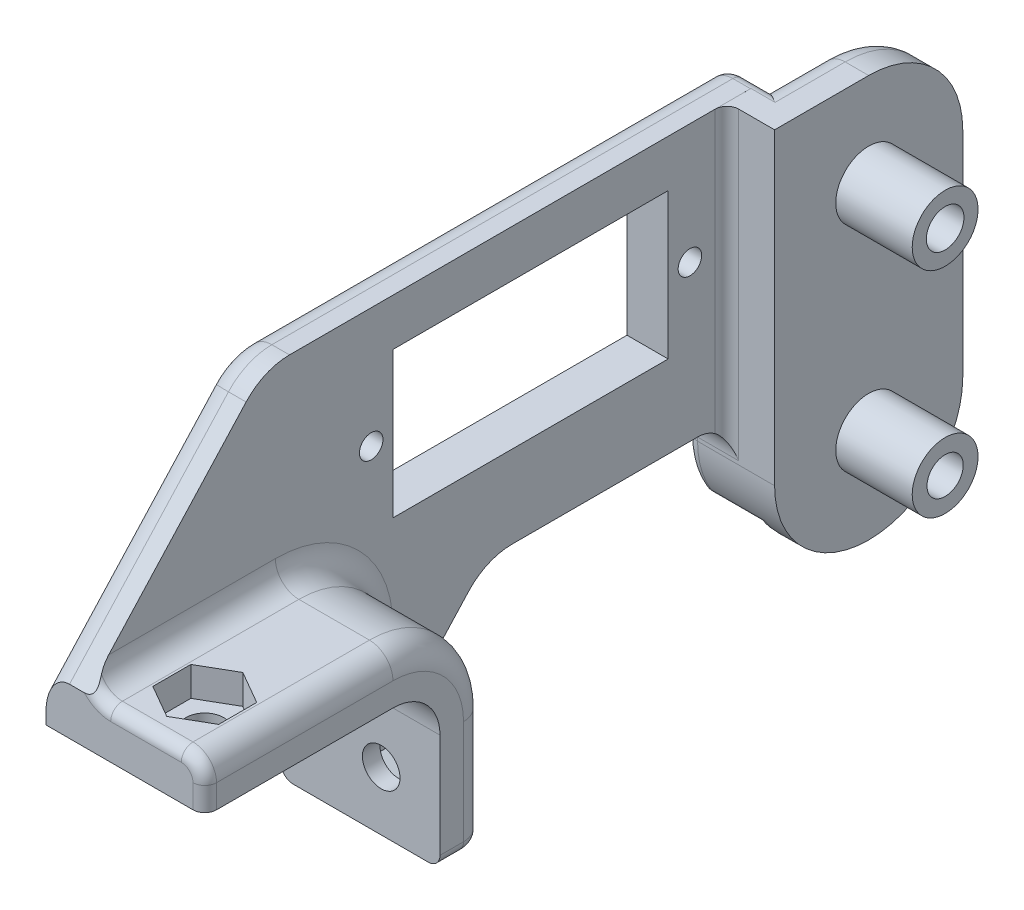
SolidWorks part; units mm, degrees
ref_plane "Plan de face" through (0, 0, 0) normal (0, 0, 1) x (1, 0, 0)
ref_plane "Plan de dessus" through (0, 0, 0) normal (0, 1, 0) x (1, 0, 0)
ref_plane "Plan de droite" through (0, 0, 0) normal (1, 0, 0) x (0, 0, -1)
sketch "Esquisse1" plane through (0, 0, 0) normal (1, 0, 0) x (0, 0, -1)
  line L0 (0, -18.8005) -> (0, 58.6965) construction
  line L1 (-11.5695, 0) -> (88.8749, 0) construction
  line L2 (88.8749, 56) -> (-77.3054, 56) construction
  line L3 (-77.3054, 76.4) -> (88.8749, 76.4) construction
  line L4 (29.4, 129.2323) -> (29.4, 55.4684) construction
  line L5 (6, 72.4) -> (29.4, 72.4)
  line L6 (6, 72.4) -> (6, 60)
  line L7 (6, 60) -> (29.4, 60)
  line L8 (29.4, 72.4) -> (29.4, 60)
  line L10 (-77.3054, 60) -> (25.8199, 60) construction
  line L11 (29.6854, 66.2) -> (-29.3479, 66.2) construction
  line L12 (31.25, 68.4) -> (31.25, 61.4374) construction
  line L13 (25.8199, 72.4) -> (-35.5995, 72.4) construction
  line L14 (17.7, 81.6265) -> (17.7, 64.3393) construction
  line L15 (50.0909, 50.1908) -> (26.7153, 50.1908) construction
  line L16 (34.4007, 50.1908) -> (34.4007, 50.5)
  line L17 (6, 35.7413) -> (6, 86.6091) construction
  line L25 (42.4, 123.4849) -> (42.4, 0.427) construction
  line L26 (50.3993, 129.2323) -> (50.3993, -14.8936) construction
  line L28 (-20, 63.2) -> (-20, 53.7149) construction
  line L29 (-20, 60) -> (-6.4867, 74.7745)
  line L30 (88.8749, 106.4) -> (-20, 106.4) construction
  line L31 (75.4059, 42.15) -> (-25.1768, 42.15) construction
  line L34 (42.4, 76.4) -> (-2.7972, 76.4)
  line L35 (75.4059, 68.4) -> (29.6854, 68.4) construction
  line L36 (-20, 60) -> (-20, 56)
  line L37 (-20, 56) -> (0, 56)
  line L38 (0, 56) -> (0, 42.15)
  line L39 (0, 42.15) -> (4, 42.15)
  line L41 (50.3993, 50.1908) -> (50.3993, 68.2926)
  line L42 (4, 30.0024) -> (4, 53.7149) construction
  line L43 (65.1359, 53) -> (8.7208, 53) construction
  line L44 (4, 42.15) -> (12.4371, 51.3745)
  line L45 (31.9007, 53) -> (16.1266, 53)
  circle A0 centre (31.25, 66.2) radius 1
  circle A1 centre (4.15, 66.2) radius 1
  arc A3 (39.3993, 50.1908) -> (45.4007, 50.1908) centre (42.4, 50.1908) ccw construction
  arc A4 (45.4007, 68.4) -> (39.3993, 68.4) centre (42.4, 68.4) ccw construction
  circle A5 centre (42.4, 68.4) radius 1.6
  circle A6 centre (42.4, 50.1908) radius 1.6
  arc A7 (34.4007, 50.1908) -> (50.3993, 50.1908) centre (42.4, 50.1908) ccw
  arc A8 (50.3993, 68.2926) -> (42.4, 76.4) centre (42.4, 68.4) ccw
  arc A9 (34.4007, 50.5) -> (31.9007, 53) centre (31.9007, 50.5) ccw
  arc A10 (12.4371, 51.3745) -> (16.1266, 53) centre (16.1266, 48) cw
  arc A11 (-6.4867, 74.7745) -> (-2.7972, 76.4) centre (-2.7972, 71.4) cw
  point P36 (34.4007, 53)
  point P95 (13.9238, 53)
  point P98 (-5, 76.4)
  dimension "D8" = 1.85
  dimension "D23" = 3
  dimension "D24" = 8
  dimension "D15" = 4
  dimension "D11" = 2.5
  dimension "D6" = 13
  dimension "D1" = 56
  dimension "D2" = 4
  dimension "D3" = 23.4
  dimension "D4" = 4
  dimension "D5" = 6.2
  dimension "D7" = 12.4
  dimension "D9" = 6
  dimension "D10" = 7.9993
  dimension "D13" = 11.7
  dimension "D18" = 20
  dimension "D19" = 30
  dimension "D20" = 42.15
extrude "Boss.-Extru.1" add sketch "Esquisse1" along normal blind 3.5
sketch "Esquisse3" plane through (3.5, 0, 0) normal (1, 0, 0) x (0, 0, -1)
  line L0 (-22.0235, 60) -> (25.8894, 60) construction
  line L1 (4, 40.1358) -> (4, 64.525) construction
  line L2 (-20, 53.8252) -> (-20, 70.4256) construction
  line L3 (-5.2658, 42.15) -> (13.7735, 42.15) construction
  line L4 (0, 42.15) -> (0, 56)
  line L5 (0, 56) -> (-20, 56)
  line L6 (-20, 56) -> (-20, 60)
  line L7 (-20, 60) -> (4, 60)
  line L8 (4, 60) -> (4, 42.15)
  line L9 (4, 42.15) -> (0, 42.15)
extrude "Boss.-Extru.2" add sketch "Esquisse3" along normal blind 10
sketch "Esquisse4" plane through (0, 0, -4) normal (0, 0, -1) x (-1, 0, 0)
  line L0 (-8.5, 37.1462) -> (-8.5, 61.6927) construction
  line L1 (-18.1862, 60) -> (-2.3726, 60) construction
  line L2 (-18.1862, 56) -> (-2.3726, 56) construction
  line L3 (-13.5, 42.15) -> (-13.5, 60) construction
  line L4 (-18.1862, 47.15) -> (-2.3726, 47.15) construction
  line L5 (-18.1862, 42.15) -> (-2.3726, 42.15) construction
  circle A0 centre (-8.5, 47.15) radius 1.6
  dimension "D1" = 4
  dimension "D2" = 5
  dimension "D3" = 5
extrude "Enlèv. mat.-Extru.2" cut sketch "Esquisse4" against normal blind 4
sketch "Esquisse5" plane through (0, 0, -4) normal (0, 0, -1) x (-1, 0, 0)
  line L1 (-8.5, 50.3832) -> (-11.3, 48.7666)
  line L2 (-11.3, 48.7666) -> (-11.3, 45.5334)
  line L3 (-11.3, 45.5334) -> (-8.5, 43.9168)
  line L4 (-8.5, 43.9168) -> (-5.7, 45.5334)
  line L5 (-5.7, 45.5334) -> (-5.7, 48.7666)
  line L6 (-5.7, 48.7666) -> (-8.5, 50.3832)
  circle A0 centre (-8.5, 47.15) radius 2.8 construction
extrude "Enlèv. mat.-Extru.3" cut sketch "Esquisse5" against normal blind 2.5
sketch "Esquisse6" plane through (0, 60, 0) normal (0, 1, 0) x (1, 0, 0)
  line L0 (8.5, -25.3519) -> (8.5, -7.8403) construction
  line L1 (17.8997, -15) -> (5.7337, -15) construction
  line L2 (13.5, -20) -> (-6.75, -20) construction
  line L3 (13.5, 4) -> (13.5, -20) construction
  circle A0 centre (8.5, -15) radius 1.6
  dimension "D1" = 5
  dimension "D2" = 5
extrude "Enlèv. mat.-Extru.4" cut sketch "Esquisse6" against normal blind 4
sketch "Esquisse7" plane through (0, 60, 0) normal (0, 1, 0) x (1, 0, 0)
  line L1 (8.5, -11.7668) -> (5.7, -13.3834)
  line L2 (5.7, -13.3834) -> (5.7, -16.6166)
  line L3 (5.7, -16.6166) -> (8.5, -18.2332)
  line L4 (8.5, -18.2332) -> (11.3, -16.6166)
  line L5 (11.3, -16.6166) -> (11.3, -13.3834)
  line L6 (11.3, -13.3834) -> (8.5, -11.7668)
  circle A0 centre (8.5, -15) radius 2.8 construction
extrude "Enlèv. mat.-Extru.5" cut sketch "Esquisse7" against normal blind 2.5
sketch "Esquisse8" plane through (3.5, 0, 0) normal (1, 0, 0) x (0, 0, -1)
  line L0 (53.0605, 68.4) -> (26.9296, 68.4) construction
  line L1 (34.4007, 81.784) -> (34.4007, 25.4726) construction
  line L2 (56.1678, 50.1908) -> (24.6056, 50.1908) construction
  line L3 (42.4, 65.4019) -> (42.4, 78.1618) construction
  line L4 (50.3993, 68.4) -> (50.3993, 50.1908)
  line L5 (34.4007, 50.1908) -> (34.4007, 76.3993)
  line L6 (34.4007, 76.3993) -> (42.4, 76.3993)
  circle A0 centre (42.4, 50.1908) radius 1.6
  arc A1 (34.4007, 50.1908) -> (50.3993, 50.1908) centre (42.4, 50.1908) ccw
  circle A2 centre (42.4, 68.4) radius 1.6
  arc A3 (50.3993, 68.4) -> (42.4, 76.3993) centre (42.4, 68.4) ccw
extrude "Boss.-Extru.3" add sketch "Esquisse8" along normal blind 4.05
sketch "Esquisse9" plane through (0, 76.4, 0) normal (0, 1, 0) x (1, 0, 0)
  line L1 (-12.6545, 37.4007) -> (13.1171, 37.4007) construction
  line L3 (3.55, 48.2513) -> (3.55, 19.1288) construction
  line L4 (7.55, 28.4511) -> (7.55, 47.2506) construction
  line L5 (3.55, 37.4007) -> (-0.3044, 37.4007)
  line L6 (3.55, 37.4007) -> (3.55, 50.6545)
  line L7 (3.55, 50.6545) -> (-0.3044, 50.6545)
  line L8 (-0.3044, 37.4007) -> (-0.3044, 50.6545)
  line L9 (13.1171, 34.4007) -> (-1.8462, 34.4007) construction
  dimension "D1" = 3
  dimension "D2" = 4
extrude "Enlèv. mat.-Extru.6" cut sketch "Esquisse9" against normal through all
sketch "Esquisse10" plane through (3.55, 0, 0) normal (-1, 0, 0) x (0, 0, 1)
  line L1 (-42.4, 47.0154) -> (-39.65, 48.6031)
  line L2 (-45.15, 69.9877) -> (-45.15, 66.8123)
  line L3 (-45.15, 66.8123) -> (-42.4, 65.2246)
  line L4 (-42.4, 65.2246) -> (-39.65, 66.8123)
  line L5 (-39.65, 66.8123) -> (-39.65, 69.9877)
  line L6 (-39.65, 69.9877) -> (-42.4, 71.5754)
  line L7 (-42.4, 71.5754) -> (-45.15, 69.9877)
  line L8 (-39.65, 48.6031) -> (-39.65, 51.7785)
  line L9 (-39.65, 51.7785) -> (-42.4, 53.3662)
  line L10 (-42.4, 53.3662) -> (-45.15, 51.7785)
  line L11 (-45.15, 51.7785) -> (-45.15, 48.6031)
  line L12 (-45.15, 48.6031) -> (-42.4, 47.0154)
  circle A0 centre (-42.4, 68.4) radius 2.75 construction
  circle A1 centre (-42.4, 50.1908) radius 2.75 construction
extrude "Enlèv. mat.-Extru.7" cut sketch "Esquisse10" against normal blind 2.5
fillet "Congé3" radius 4 1 edges at (6.75, 56, 0)
fillet "Congé4" radius 8 1 edges at (8.5, 60, -4)
fillet "Congé5" radius 2 13 edges at (3.55, 42.9804, -45.8639) (3.55, 59.2954, -50.3993) (3.55, 74.0563, -48.0563) (0, 67.3873, 13.2433) (0, 75.9756, 4.813) (13.5, 47.075, -4) (13.5, 57.6569, -1.6569) (3.5, 60, 12) (3.5, 47.075, -4) (3.55, 76.3993, -39.9004) (0, 76.4, -17.3018) (13.5, 60, 12) (3.5, 57.6569, -1.6569)
fillet "Congé6" radius 1 18 edges at (0, 46.7623, -8.2185) (0, 52.5756, -14.1107) (0, 46.7269, -35.1896) (0, 50.3454, -34.4007) (0, 52.2678, -33.6685) (0, 59.1731, -37.4007) (0.5858, 75.8142, -37.4007) (13.5, 57, 20) (12.9142, 59.4142, 20) (13.5, 42.15, -1) (12.9142, 42.15, -3.4142) (0, 42.15, -2) (0, 53, -24.0137) (2.775, 43.9462, -37.4007) (2.75, 76.4, -37.4007) (8.5, 60, 20) (8.5, 42.15, -4) (3.5, 63.4496, -34.4007)
sketch "Esquisse11" plane through (7.55, 0, 0) normal (1, 0, 0) x (0, 0, -1)
  circle A0 centre (42.4, 68.4) radius 1.6
  circle A1 centre (42.4, 68.4) radius 2.8
  circle A2 centre (42.4, 50.1908) radius 1.54
  circle A3 centre (42.4, 50.1908) radius 2.8
extrude "Boss.-Extru.4" add sketch "Esquisse11" along normal blind 6.5
